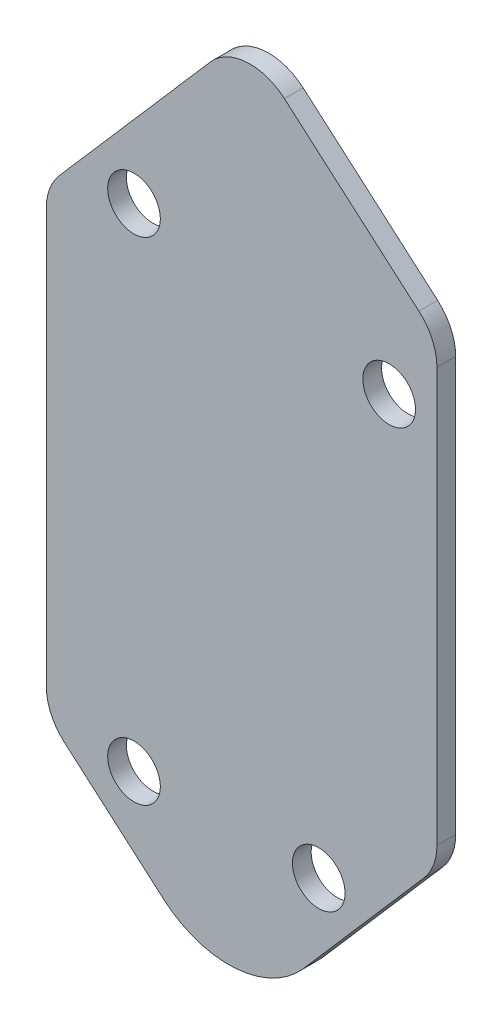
SolidWorks part; units mm, degrees
ref_plane "Front" through (0, 0, 0) normal (0, 0, 1) x (1, 0, 0)
ref_plane "Top" through (0, 0, 0) normal (0, 1, 0) x (1, 0, 0)
ref_plane "Right" through (0, 0, 0) normal (1, 0, 0) x (0, 0, -1)
ref_plane "Plane1"
sketch "Sketch1" plane through (0, 0, 82.1182) normal (0, 0, -1) x (-1, 0, 0)
  line L6 (777.7097, -55.7498) -> (794.0493, -74.565)
  line L7 (777.7097, -55.7498) -> (794.0493, -74.565)
  line L8 (813.757, -75.9528) -> (827.1944, -64.2834)
  line L9 (813.757, -75.9528) -> (827.1944, -64.2834)
  line L10 (829.818, -58.5301) -> (829.818, -2.3863)
  line L11 (829.818, -58.5301) -> (829.818, -2.3863)
  line L84 (827.9513, 2.6101) -> (807.4481, 26.2197)
  line L85 (827.9513, 2.6101) -> (807.4481, 26.2197)
  line L86 (796.6984, 26.9766) -> (778.4666, 11.1437)
  line L87 (796.6984, 26.9766) -> (778.4666, 11.1437)
  line L88 (775.843, 5.3903) -> (775.843, -50.7535)
  line L89 (775.843, 5.3903) -> (775.843, -50.7535)
  arc A6 (794.0493, -74.565) -> (813.757, -75.9528) centre (804.5971, -65.405) ccw
  arc A7 (794.0493, -74.565) -> (813.757, -75.9528) centre (804.5971, -65.405) ccw
  arc A8 (827.1944, -64.2834) -> (829.818, -58.5301) centre (822.198, -58.5301) ccw
  arc A9 (827.1944, -64.2834) -> (829.818, -58.5301) centre (822.198, -58.5301) ccw
  arc A10 (829.818, -2.3863) -> (827.9513, 2.6101) centre (822.198, -2.3863) ccw
  arc A11 (829.818, -2.3863) -> (827.9513, 2.6101) centre (822.198, -2.3863) ccw
  arc A84 (807.4481, 26.2197) -> (796.6984, 26.9766) centre (801.6947, 21.2233) ccw
  arc A85 (807.4481, 26.2197) -> (796.6984, 26.9766) centre (801.6947, 21.2233) ccw
  arc A86 (778.4666, 11.1437) -> (775.843, 5.3903) centre (783.463, 5.3903) ccw
  arc A87 (778.4666, 11.1437) -> (775.843, 5.3903) centre (783.463, 5.3903) ccw
  arc A88 (775.843, -50.7535) -> (777.7097, -55.7498) centre (783.463, -50.7535) ccw
  arc A89 (775.843, -50.7535) -> (777.7097, -55.7498) centre (783.463, -50.7535) ccw
sketch "Sketch2" plane through (0, 0, 82.1182) normal (0, 0, -1) x (-1, 0, 0)
  line L6 (778.0932, -55.4168) -> (794.4328, -74.2319)
  line L7 (778.0932, -55.4168) -> (794.4328, -74.2319)
  line L8 (813.424, -75.5692) -> (826.8613, -63.8999)
  line L9 (813.424, -75.5692) -> (826.8613, -63.8999)
  line L10 (829.31, -58.5301) -> (829.31, -2.3863)
  line L11 (829.31, -58.5301) -> (829.31, -2.3863)
  line L18 (827.5678, 2.277) -> (807.0645, 25.8866)
  line L19 (827.5678, 2.277) -> (807.0645, 25.8866)
  line L20 (797.0315, 26.5931) -> (778.7997, 10.7601)
  line L21 (797.0315, 26.5931) -> (778.7997, 10.7601)
  line L22 (776.351, 5.3903) -> (776.351, -50.7535)
  line L23 (776.351, 5.3903) -> (776.351, -50.7535)
  arc A6 (794.4328, -74.2319) -> (813.424, -75.5692) centre (804.5971, -65.405) ccw
  arc A7 (794.4328, -74.2319) -> (813.424, -75.5692) centre (804.5971, -65.405) ccw
  arc A8 (826.8613, -63.8999) -> (829.31, -58.5301) centre (822.198, -58.5301) ccw
  arc A9 (826.8613, -63.8999) -> (829.31, -58.5301) centre (822.198, -58.5301) ccw
  arc A10 (829.31, -2.3863) -> (827.5678, 2.277) centre (822.198, -2.3863) ccw
  arc A11 (829.31, -2.3863) -> (827.5678, 2.277) centre (822.198, -2.3863) ccw
  arc A18 (807.0645, 25.8866) -> (797.0315, 26.5931) centre (801.6947, 21.2233) ccw
  arc A19 (807.0645, 25.8866) -> (797.0315, 26.5931) centre (801.6947, 21.2233) ccw
  arc A20 (778.7997, 10.7601) -> (776.351, 5.3903) centre (783.463, 5.3903) ccw
  arc A21 (778.7997, 10.7601) -> (776.351, 5.3903) centre (783.463, 5.3903) ccw
  arc A22 (776.351, -50.7535) -> (778.0932, -55.4168) centre (783.463, -50.7535) ccw
  arc A23 (776.351, -50.7535) -> (778.0932, -55.4168) centre (783.463, -50.7535) ccw
extrude "Boss-Extrude1" add sketch "Sketch2" against normal blind 2.54 flip side to cut
hole_wizard "Hole1" positions "Point_Sketch" profile "Profil_Sketch" hole size "Ø0.15" standard "ISO"
sketch "Point_Sketch" plane through (-779.1737, 9.5995, 82.1182) normal (0, 0, 1) x (-1, 0, 0)
  point P0 (3.6543, 10.6011)
  point P2 (38.2513, 5.5211)
  point P4 (13.2044, 72.1961)
  point P6 (38.2513, 72.1961)
sketch "Profil_Sketch" plane through (-782.828, -1.0017, 82.1182) normal (1, 0, 0) x (0, 1, 0)
  line L0 (0, 0) -> (0, 2.54)
  line L1 (0, 2.54) -> (3.5687, 2.54)
  line L2 (3.5687, 2.54) -> (3.5687, 0)
  line L5 (3.5687, 0) -> (0, 0)
  line L11 (0, -6.35) -> (0, 107.95) construction
  dimension "Diameter" = 7.1374
  dimension "Thru Hole Depth" = 2.54
other "usin_DL090_.25-20x1.75-SHCS<1>"
